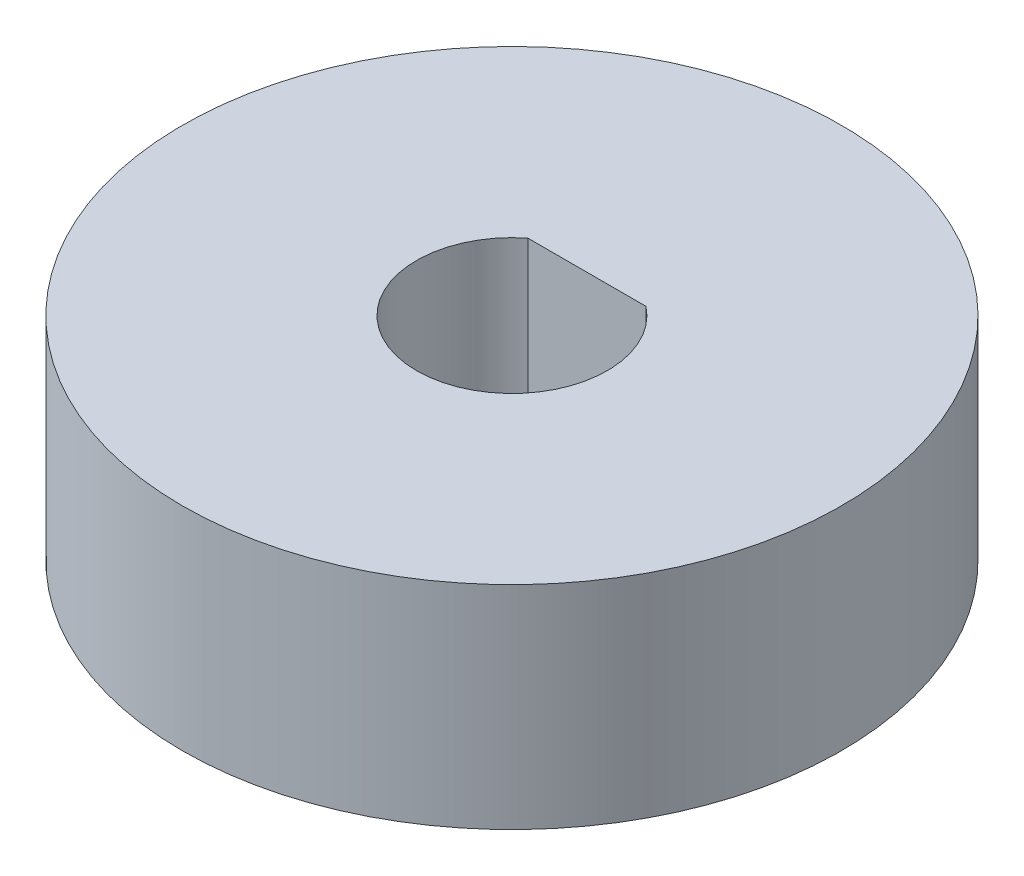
SolidWorks part; units mm, degrees
ref_plane "Front Plane" through (0, 0, 0) normal (0, 0, 1) x (1, 0, 0)
ref_plane "Top Plane" through (0, 0, 0) normal (0, 1, 0) x (1, 0, 0)
ref_plane "Right Plane" through (0, 0, 0) normal (1, 0, 0) x (0, 0, -1)
sketch "Sketch1" plane through (0, 0, 0) normal (0, 1, 0) x (1, 0, 0)
  line L4 (1.9478, 2.4756) -> (-1.9478, 2.4756)
  circle A0 centre (0, 0) radius 10.875
  arc A1 (-1.9478, 2.4756) -> (1.9478, 2.4756) centre (0, 0) ccw
  dimension "D1" = 2.4756
  dimension "D2" = 3.15
  dimension "D3" = 21.75
extrude "Extrude1" add sketch "Sketch1" along normal blind 7
